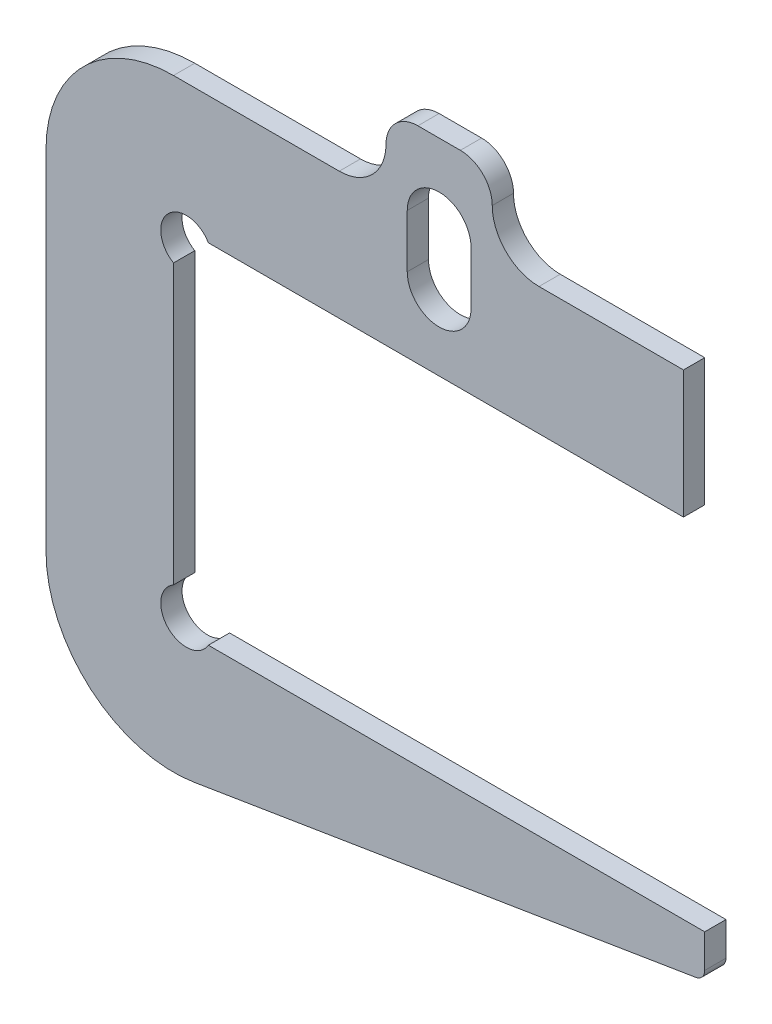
SolidWorks part; units mm, degrees
ref_plane "Face" through (0, 0, 0) normal (0, 0, 1) x (1, 0, 0)
ref_plane "Dessus" through (0, 0, 0) normal (0, 1, 0) x (1, 0, 0)
ref_plane "Droite" through (0, 0, 0) normal (1, 0, 0) x (0, 0, -1)
sketch "Esquisse1" plane through (0, 0, 0) normal (0, 0, 1) x (1, 0, 0)
  line L0 (575, -300) -> (-543.0385, -300)
  line L1 (-625, -381.9615) -> (-625, -1038.0385)
  line L2 (-75, 0) -> (-75, -125)
  line L3 (-543.0385, -1120) -> (625, -1120)
  line L4 (75, 0) -> (75, -125)
  line L5 (625, -1120) -> (625, -1198.7487)
  line L6 (604.0261, -1223.4224) -> (-576.6867, -1416.0842)
  line L7 (-925, -1120) -> (-925, -300)
  line L8 (-625, 0) -> (-235, 0)
  line L9 (-235, 110) -> (235, 110) construction
  line L10 (-50, 185) -> (50, 185)
  line L11 (-625, -710) -> (1121.591, -710) construction
  line L12 (235, 0) -> (575, 0)
  line L13 (575, 0) -> (575, -300)
  line L14 (0, 185) -> (0, -304.7531) construction
  arc A0 (75, 0) -> (-75, 0) centre (0, 0) ccw
  arc A1 (-75, -125) -> (75, -125) centre (0, -125) ccw
  arc A2 (-576.6867, -1416.0842) -> (-925, -1120) centre (-625, -1120) cw
  arc A3 (-925, -300) -> (-625, 0) centre (-625, -300) cw
  arc A4 (625, -1198.7487) -> (604.0261, -1223.4224) centre (600, -1198.7487) cw
  arc A5 (-235, 0) -> (-125, 110) centre (-235, 110) ccw
  arc A6 (50, 185) -> (125, 110) centre (50, 110) cw
  arc A7 (-125, 110) -> (-50, 185) centre (-50, 110) cw
  arc A8 (125, 110) -> (235, 0) centre (235, 110) ccw
  arc A9 (-543.0385, -300) -> (-625, -381.9615) centre (-595, -330) ccw
  arc A10 (-625, -1038.0385) -> (-543.0385, -1120) centre (-595, -1090) ccw
  point P25 (625, -1220)
  dimension "D1" = 75
  dimension "D10" = 300
  dimension "D11" = 120
  dimension "D12" = 25
  dimension "D13" = 110
  dimension "D14" = 380
  dimension "D15" = 625
  dimension "D2" = 125
  dimension "D3" = 300
  dimension "D4" = 1200
  dimension "D5" = 250
  dimension "D6" = 100
  dimension "D7" = 1250
  dimension "D8" = 820
  dimension "D9" = 300
  dimension "D16" = 30
extrude "Boss.-Extru.1" add sketch "Esquisse1" along normal mid plane 50
